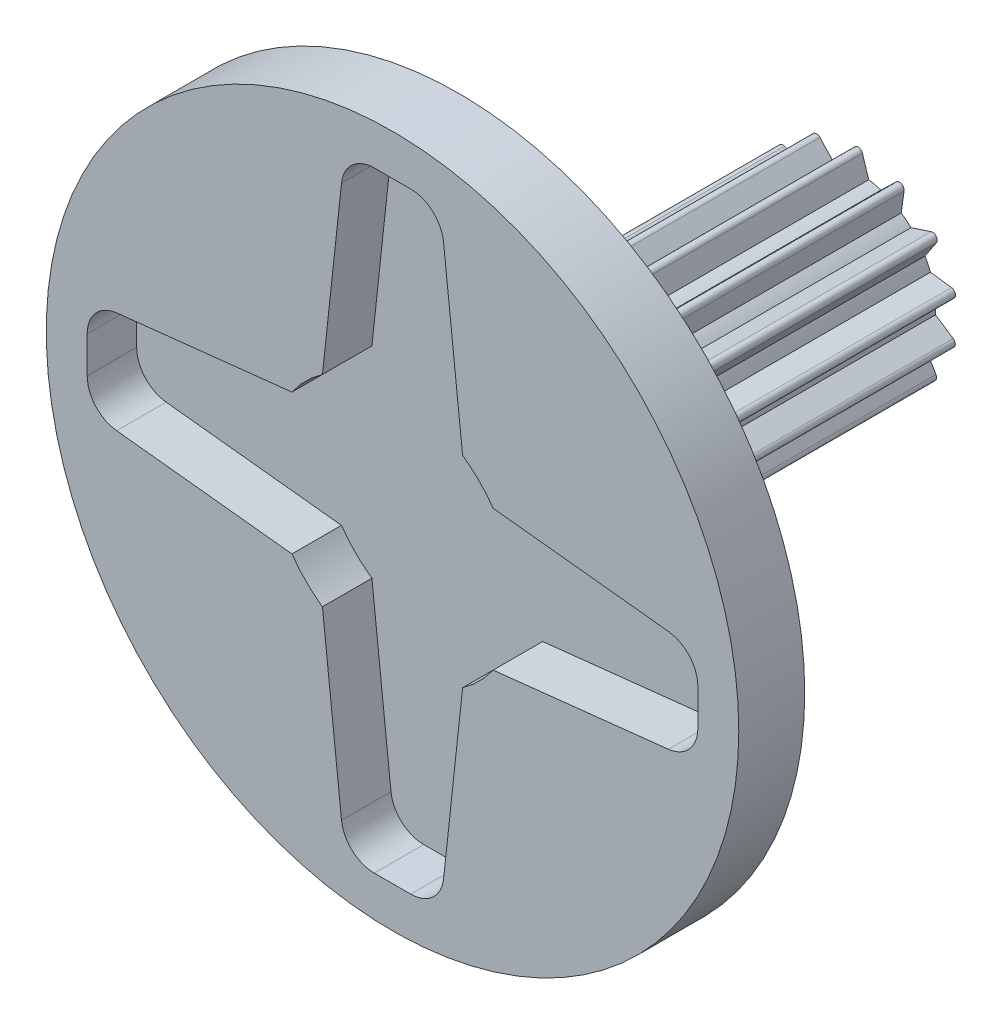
SolidWorks part; units mm, degrees
ref_plane "Front Plane" through (0, 0, 0) normal (0, 0, 1) x (1, 0, 0)
ref_plane "Top Plane" through (0, 0, 0) normal (0, 1, 0) x (1, 0, 0)
ref_plane "Right Plane" through (0, 0, 0) normal (1, 0, 0) x (0, 0, -1)
sketch "Sketch1" plane through (0, 0, 0) normal (0, 0, 1) x (1, 0, 0)
  line L1 (4.5314, 5.8954) -> (4.25, 6.1014)
  line L2 (4.25, 6.1014) -> (3.0939, 16.7326)
  line L3 (-3.0939, 16.7326) -> (-4.25, 6.1014)
  line L5 (1.1057, 18.5164) -> (-1.1057, 18.5164)
  line L6 (6.1014, -4.25) -> (16.7326, -3.0939)
  line L7 (16.7326, 3.0939) -> (6.1014, 4.25)
  line L9 (18.5164, -1.1057) -> (18.5164, 1.1057)
  line L10 (-4.25, -6.1014) -> (-3.0939, -16.7326)
  line L11 (3.0939, -16.7326) -> (4.25, -6.1014)
  line L12 (-16.7326, -3.0939) -> (-6.1014, -4.25)
  line L13 (-18.5164, 1.1057) -> (-18.5164, -1.1057)
  line L14 (-6.1014, 4.25) -> (-16.7326, 3.0939)
  line L22 (-1.1057, -18.5164) -> (1.1057, -18.5164)
  arc A0 (-4.25, 6.1014) -> (-6.1014, 4.25) centre (0, 0) ccw
  circle A1 centre (0, 0) radius 21
  arc A2 (-6.1014, -4.25) -> (-4.25, -6.1014) centre (0, 0) ccw
  arc A5 (-3.0939, 16.7326) -> (-1.1057, 18.5164) centre (-1.1057, 16.5164) cw
  arc A6 (1.1057, 18.5164) -> (3.0939, 16.7326) centre (1.1057, 16.5164) cw
  arc A7 (16.7326, 3.0939) -> (18.5164, 1.1057) centre (16.5164, 1.1057) cw
  arc A8 (18.5164, -1.1057) -> (16.7326, -3.0939) centre (16.5164, -1.1057) cw
  arc A9 (3.0939, -16.7326) -> (1.1057, -18.5164) centre (1.1057, -16.5164) cw
  arc A10 (-1.1057, -18.5164) -> (-3.0939, -16.7326) centre (-1.1057, -16.5164) cw
  arc A11 (-16.7326, -3.0939) -> (-18.5164, -1.1057) centre (-16.5164, -1.1057) cw
  arc A12 (-18.5164, 1.1057) -> (-16.7326, 3.0939) centre (-16.5164, 1.1057) cw
  arc A13 (6.1014, 4.25) -> (4.5314, 5.8954) centre (0, 0) ccw
  arc A15 (4.25, -6.1014) -> (6.1014, -4.25) centre (0, 0) ccw
  point P25 (0, 0)
  point P26 (0.997, 1.0052)
  point P40 (2.5875, 20.5185)
  point P43 (-2.4125, 20.5185)
  point P64 (0, 0)
  dimension "D1" = 5
  dimension "D3" = 4
extrude "Boss-Extrude1" add sketch "Sketch1" along normal blind 3
sketch "Sketch2" plane through (0, 0, 0) normal (0, 0, 1) x (1, 0, 0)
  circle A0 centre (0, 0) radius 21
extrude "Boss-Extrude2" add sketch "Sketch2" against normal blind 1
sketch "Sketch3" plane through (0, 0, 0) normal (0, 0, 1) x (1, 0, 0)
  line L1 (0.6806, 4.6937) -> (0.2992, 5.887)
  line L2 (-0.2328, 5.8993) -> (-0.6806, 4.6937)
  line L3 (2.3499, 5.4161) -> (1.4233, 4.5242)
  line L4 (2.6497, 3.9336) -> (2.8238, 5.1742)
  line L6 (4.4671, 3.8602) -> (3.2453, 3.4586)
  line L7 (4.094, 2.3944) -> (4.7892, 3.4366)
  line L9 (5.6996, 1.5397) -> (4.4246, 1.708)
  line L10 (4.7275, 0.3809) -> (5.806, 1.0183)
  line L12 (5.8032, -1.0858) -> (4.7275, -0.3809)
  line L13 (4.4246, -1.708) -> (5.6729, -1.6016)
  line L15 (4.7574, -3.4962) -> (4.094, -2.3944)
  line L16 (3.2453, -3.4586) -> (4.4161, -3.9044)
  line L18 (2.7694, -5.2141) -> (2.6497, -3.9336)
  line L19 (1.4233, -4.5242) -> (2.2848, -5.4338)
  line L21 (0.2328, -5.8993) -> (0.6806, -4.6937)
  line L22 (-0.6806, -4.6937) -> (-0.2992, -5.887)
  line L24 (-2.3499, -5.4161) -> (-1.4233, -4.5242)
  line L25 (-2.6497, -3.9336) -> (-2.8238, -5.1742)
  line L27 (-4.4671, -3.8602) -> (-3.2453, -3.4586)
  line L28 (-4.094, -2.3944) -> (-4.7892, -3.4366)
  line L30 (-5.6996, -1.5397) -> (-4.4246, -1.708)
  line L31 (-4.7275, -0.3809) -> (-5.806, -1.0183)
  line L33 (-5.8032, 1.0858) -> (-4.7275, 0.3809)
  line L34 (-4.4246, 1.708) -> (-5.6729, 1.6016)
  line L36 (-4.7574, 3.4962) -> (-4.094, 2.3944)
  line L37 (-3.2453, 3.4586) -> (-4.4161, 3.9044)
  line L39 (-2.7694, 5.2141) -> (-2.6497, 3.9336)
  line L40 (-1.4233, 4.5242) -> (-2.2848, 5.4338)
  arc A0 (3.2453, 3.4586) -> (2.6497, 3.9336) centre (0, 0) ccw
  arc A1 (0.2992, 5.887) -> (-0.2328, 5.8993) centre (0.0311, 5.8013) ccw
  arc A2 (2.8238, 5.1742) -> (2.3499, 5.4161) centre (2.5451, 5.2134) ccw
  arc A3 (4.7892, 3.4366) -> (4.4671, 3.8602) centre (4.555, 3.5928) ccw
  arc A4 (5.806, 1.0183) -> (5.6996, 1.5397) centre (5.6628, 1.2606) ccw
  arc A5 (5.6729, -1.6016) -> (5.8032, -1.0858) centre (5.649, -1.3212) ccw
  arc A6 (4.4161, -3.9044) -> (4.7574, -3.4962) centre (4.5163, -3.6414) ccw
  arc A7 (2.2848, -5.4338) -> (2.7694, -5.2141) centre (2.4891, -5.2403) ccw
  arc A8 (-0.2992, -5.887) -> (0.2328, -5.8993) centre (-0.0311, -5.8013) ccw
  arc A9 (-2.8238, -5.1742) -> (-2.3499, -5.4161) centre (-2.5451, -5.2134) ccw
  arc A10 (-4.7892, -3.4366) -> (-4.4671, -3.8602) centre (-4.555, -3.5928) ccw
  arc A11 (-5.806, -1.0183) -> (-5.6996, -1.5397) centre (-5.6628, -1.2606) ccw
  arc A12 (-5.6729, 1.6016) -> (-5.8032, 1.0858) centre (-5.649, 1.3212) ccw
  arc A13 (-4.4161, 3.9044) -> (-4.7574, 3.4962) centre (-4.5163, 3.6414) ccw
  arc A14 (-2.2848, 5.4338) -> (-2.7694, 5.2141) centre (-2.4891, 5.2403) ccw
  arc A15 (1.4233, 4.5242) -> (0.6806, 4.6937) centre (0, 0) ccw
  arc A16 (-0.6806, 4.6937) -> (-1.4233, 4.5242) centre (0, 0) ccw
  arc A17 (-2.6497, 3.9336) -> (-3.2453, 3.4586) centre (0, 0) ccw
  arc A18 (-4.094, 2.3944) -> (-4.4246, 1.708) centre (0, 0) ccw
  arc A19 (-4.7275, 0.3809) -> (-4.7275, -0.3809) centre (0, 0) ccw
  arc A20 (-4.4246, -1.708) -> (-4.094, -2.3944) centre (0, 0) ccw
  arc A21 (-3.2453, -3.4586) -> (-2.6497, -3.9336) centre (0, 0) ccw
  arc A22 (-1.4233, -4.5242) -> (-0.6806, -4.6937) centre (0, 0) ccw
  arc A23 (0.6806, -4.6937) -> (1.4233, -4.5242) centre (0, 0) ccw
  arc A24 (2.6497, -3.9336) -> (3.2453, -3.4586) centre (0, 0) ccw
  arc A25 (4.094, -2.3944) -> (4.4246, -1.708) centre (0, 0) ccw
  arc A26 (4.7275, -0.3809) -> (4.7275, 0.3809) centre (0, 0) ccw
  arc A27 (4.4246, 1.708) -> (4.094, 2.3944) centre (0, 0) ccw
  point P76 (0, 0)
  point P99 (0, 0)
  dimension "D1" = 14
extrude "Boss-Extrude3" add sketch "Sketch3" against normal blind 25.2
